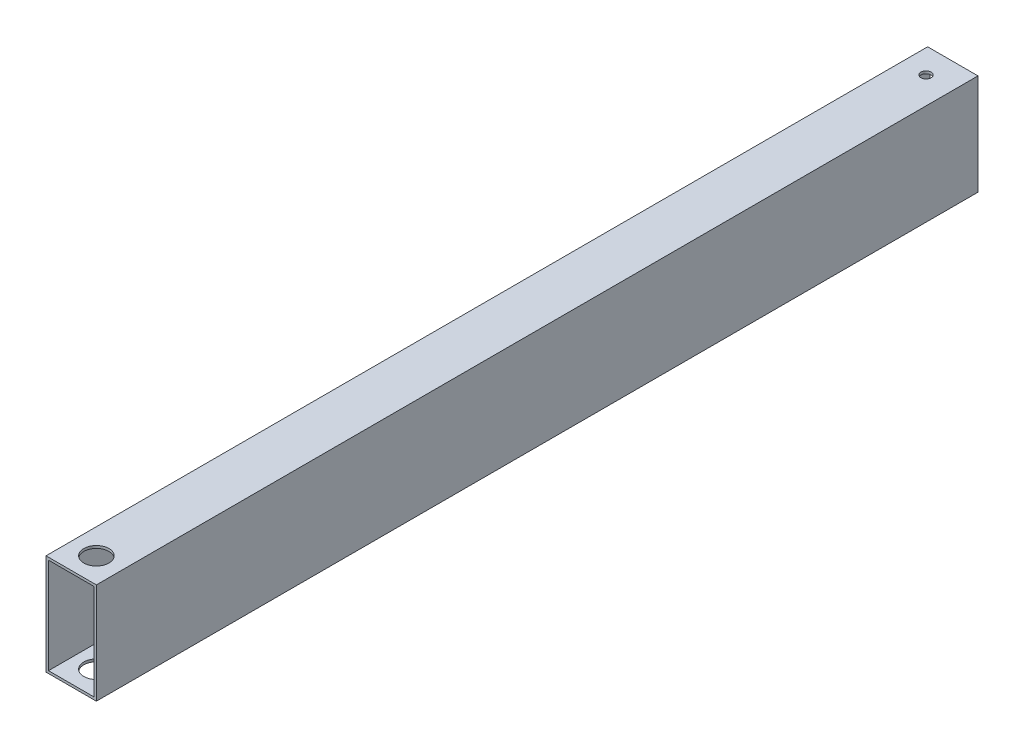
SolidWorks part; units mm, degrees
ref_plane "Plan de face" through (0, 0, 0) normal (0, 0, 1) x (1, 0, 0)
ref_plane "Plan de dessus" through (0, 0, 0) normal (0, 1, 0) x (1, 0, 0)
ref_plane "Plan de droite" through (0, 0, 0) normal (1, 0, 0) x (0, 0, -1)
sketch "Esquisse1" plane through (0, 0, 0) normal (0, 0, 1) x (1, 0, 0)
  line L0 (2, 78) -> (38, 78)
  line L1 (0, 0) -> (40, 0)
  line L2 (0, 0) -> (0, 80)
  line L3 (0, 80) -> (40, 80)
  line L4 (40, 0) -> (40, 80)
  line L5 (38, 2) -> (38, 78)
  line L6 (2, 2) -> (38, 2)
  line L7 (2, 2) -> (2, 78)
  dimension "D1" = 40
  dimension "D2" = 80
  dimension "D3" = 2
extrude "Extrusion1" add sketch "Esquisse1" along normal blind 700
sketch "Esquisse2" plane through (0, 80, 0) normal (0, 1, 0) x (1, 0, 0)
  line L0 (20, -700) -> (20, -678.4681) construction
  line L1 (40, -700) -> (0, -700) construction
  circle A0 centre (20, -680) radius 10
  dimension "D1" = 20
  dimension "D2" = 20
extrude "Extrusion2" cut sketch "Esquisse2" against normal through all
sketch "Esquisse3" plane through (0, 80, 0) normal (0, 1, 0) x (1, 0, 0)
  line L0 (40, 0) -> (0, 0) construction
  circle A0 centre (18.7357, -20) radius 4
  dimension "D1" = 20
  dimension "D2" = 8
extrude "Extrusion3" cut sketch "Esquisse3" against normal through all
